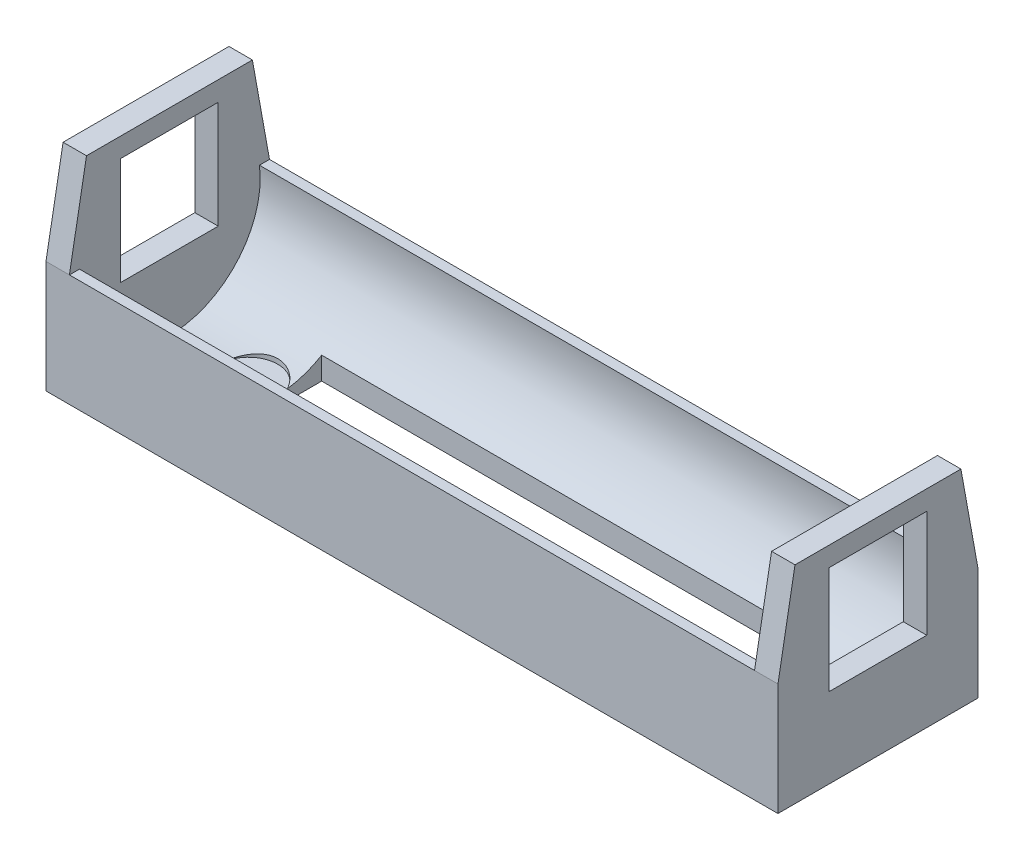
SolidWorks part; units mm, degrees
ref_plane "Plan de face" through (0, 0, 0) normal (0, 0, 1) x (1, 0, 0)
ref_plane "Plan de dessus" through (0, 0, 0) normal (0, 1, 0) x (1, 0, 0)
ref_plane "Plan de droite" through (0, 0, 0) normal (1, 0, 0) x (0, 0, -1)
sketch "Esquisse1" plane through (0, 0, 0) normal (1, 0, 0) x (0, 0, -1)
  line L0 (-8.5, 21.2) -> (-10.25, 11.5)
  line L1 (-10.25, 11.5) -> (-10.25, 0)
  line L2 (-10.25, 0) -> (10.25, 0)
  line L3 (10.25, 0) -> (10.25, 11.5)
  line L4 (10.25, 11.5) -> (8.5, 21.2)
  line L5 (8.5, 21.2) -> (-8.5, 21.2)
  line L6 (0, 21.2) -> (0, 0) construction
  line L8 (-5, 8.2) -> (5, 8.2)
  line L9 (-5, 8.2) -> (-5, 19.2)
  line L10 (-5, 19.2) -> (5, 19.2)
  line L11 (5, 8.2) -> (5, 19.2)
  line L12 (-5, 8.2) -> (5, 19.2) construction
  line L13 (-5, 19.2) -> (5, 8.2) construction
  point P10 (0, 13.7)
  dimension "D1" = 20.5
  dimension "D2" = 21.2
  dimension "D3" = 11.5
  dimension "D4" = 17
  dimension "D5" = 10
  dimension "D6" = 11
  dimension "D7" = 2
extrude "Boss.-Extru.1" add sketch "Esquisse1" along normal mid plane 75
sketch "Esquisse2" plane through (0, 0, 0) normal (0, 0, 1) x (1, 0, 0)
  line L0 (37.5, 21.2) -> (-37.5, 21.2) construction
  line L1 (35.1, 21.2) -> (-35.1, 21.2)
  line L2 (35.1, 21.2) -> (35.1, 11.5)
  line L3 (35.1, 11.5) -> (-35.1, 11.5)
  line L4 (-35.1, 21.2) -> (-35.1, 11.5)
  line L5 (37.5, 11.5) -> (-37.5, 11.5) construction
  line L6 (37.5, 21.2) -> (37.5, 11.5) construction
  line L7 (0, 21.2) -> (0, 0) construction
  dimension "D1" = 2.4
extrude "Enlèv. mat.-Extru.1" cut sketch "Esquisse2" against normal through all both and the other way through all
sketch "Esquisse3" plane through (-35.1, 0, 0) normal (1, 0, 0) x (0, 0, -1)
  line L0 (-10.25, 0) -> (10.25, 0) construction
  circle A0 centre (0, 10.3) radius 9.3
  dimension "D1" = 18.6
  dimension "D2" = 1
extrude "Enlèv. mat.-Extru.2" cut sketch "Esquisse3" along normal up to surface (70.2 mm away)
sketch "Esquisse4" plane through (0, 0, 0) normal (0, 1, 0) x (1, 0, 0)
  line L1 (-24.25, 4.75) -> (24.25, 4.75)
  line L2 (-24.25, 4.75) -> (-24.25, -4.75)
  line L3 (-24.25, -4.75) -> (24.25, -4.75)
  line L4 (24.25, 4.75) -> (24.25, -4.75)
  line L5 (-24.25, 4.75) -> (24.25, -4.75) construction
  line L6 (-24.25, -4.75) -> (24.25, 4.75) construction
  point P0 (0, 0)
  dimension "D1" = 48.5
  dimension "D2" = 9.5
extrude "Enlèv. mat.-Extru.4" cut sketch "Esquisse4" along normal through all
sketch "Esquisse5" plane through (0, 0, 0) normal (0, 1, 0) x (1, 0, 0)
  line L0 (0, 0) -> (0, 10.25) construction
  line L1 (-35.1, 10.25) -> (35.1, 10.25) construction
  circle A0 centre (-27, 0) radius 1.2
  circle A1 centre (27, 0) radius 1.2
  dimension "D1" = 2.4
  dimension "D2" = 54
extrude "Enlèv. mat.-Extru.5" cut sketch "Esquisse5" along normal through all
ref_plane "Plan1" through (0, 1, 0) normal (0, 1, 0) x (1, 0, 0)
sketch "Esquisse6" plane through (0, 1, 0) normal (0, 1, 0) x (1, 0, 0)
  circle A0 centre (-27, 0) radius 3
  circle A1 centre (27, 0) radius 3
  dimension "D1" = 6
extrude "Enlèv. mat.-Extru.6" cut sketch "Esquisse6" along normal through all
